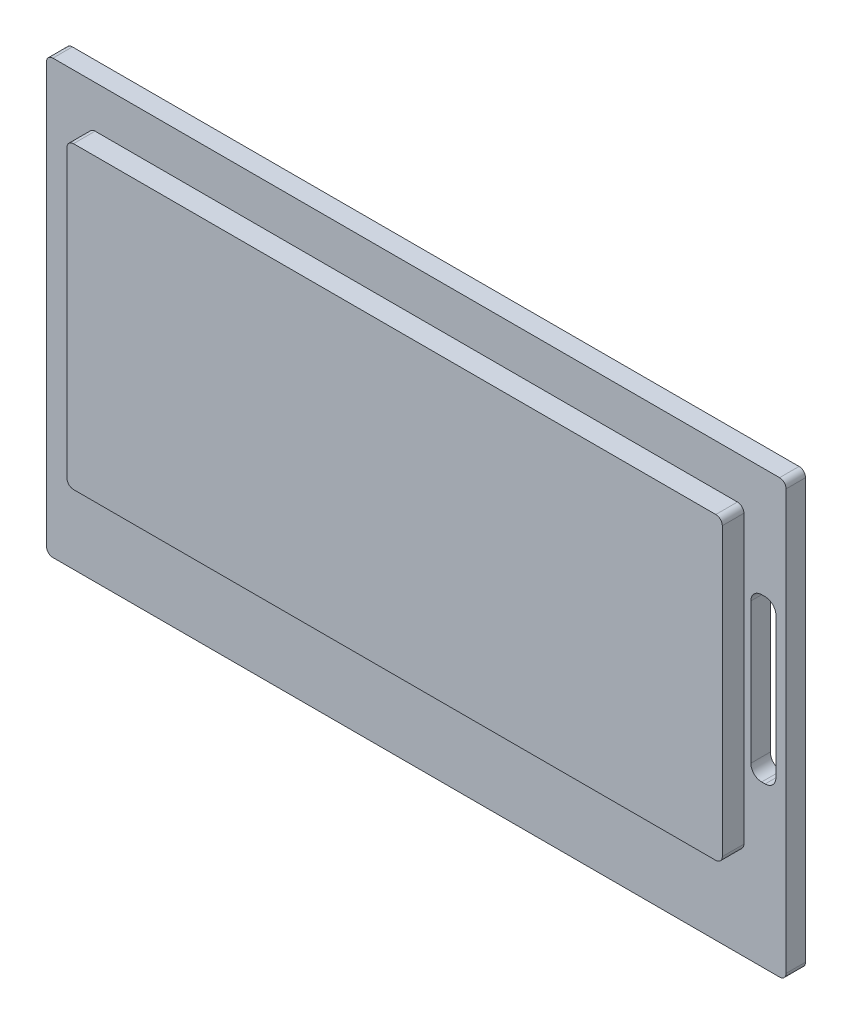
SolidWorks part; units mm, degrees
ref_plane "Plan de face" through (0, 0, 0) normal (0, 0, 1) x (1, 0, 0)
ref_plane "Plan de dessus" through (0, 0, 0) normal (0, 1, 0) x (1, 0, 0)
ref_plane "Plan de droite" through (0, 0, 0) normal (1, 0, 0) x (0, 0, -1)
sketch "Esquisse2" plane through (0, 0, 0) normal (0, 0, 1) x (1, 0, 0)
  line L1 (-51.079, 159.7342) -> (284.921, 159.7342)
  line L2 (-54.079, 156.7342) -> (-54.079, -37.2658)
  line L3 (-51.079, -40.2658) -> (284.921, -40.2658)
  line L4 (287.921, 156.7342) -> (287.921, -37.2658)
  arc A0 (284.921, 159.7342) -> (287.921, 156.7342) centre (284.921, 156.7342) cw
  arc A1 (284.921, -40.2658) -> (287.921, -37.2658) centre (284.921, -37.2658) ccw
  arc A2 (-54.079, -37.2658) -> (-51.079, -40.2658) centre (-51.079, -37.2658) ccw
  arc A3 (-51.079, 159.7342) -> (-54.079, 156.7342) centre (-51.079, 156.7342) ccw
  dimension "D3" = 3
  dimension "D1" = 342
  dimension "D2" = 200
extrude "Boss.-Extru.1" add sketch "Esquisse2" along normal blind 19
sketch "Esquisse3" plane through (0, 0, 19) normal (0, 0, 1) x (1, 0, 0)
  line L0 (284.921, 159.7342) -> (-51.079, 159.7342) construction
  line L1 (-31.579, 140.2342) -> (265.421, 140.2342)
  line L2 (-34.579, 137.2342) -> (-34.579, 4.7342)
  line L3 (-31.579, 1.7342) -> (265.421, 1.7342)
  line L4 (268.421, 137.2342) -> (268.421, 4.7342)
  line L5 (287.921, -37.2658) -> (287.921, 156.7342) construction
  line L6 (-54.079, 156.7342) -> (-54.079, -37.2658) construction
  line L7 (-51.079, -40.2658) -> (284.921, -40.2658) construction
  arc A0 (-31.579, 140.2342) -> (-34.579, 137.2342) centre (-31.579, 137.2342) ccw
  arc A1 (-34.579, 4.7342) -> (-31.579, 1.7342) centre (-31.579, 4.7342) ccw
  arc A2 (265.421, 1.7342) -> (268.421, 4.7342) centre (265.421, 4.7342) ccw
  arc A3 (265.421, 140.2342) -> (268.421, 137.2342) centre (265.421, 137.2342) cw
  dimension "D5" = 3
  dimension "D1" = 19.5
  dimension "D2" = 19.5
  dimension "D3" = 19.5
  dimension "D4" = 42
extrude "Enlèv. mat.-Extru.1" cut sketch "Esquisse3" against normal blind 10 flip side to cut
sketch "Esquisse5" plane through (0, 0, 0) normal (0, 0, -1) x (-1, 0, 0)
  line L5 (-278.221, 108.7342) -> (-276.621, 108.7342)
  line L6 (-283.221, 103.7342) -> (-283.221, 38.7342)
  line L7 (-278.221, 33.7342) -> (-276.621, 33.7342)
  line L8 (-271.621, 103.7342) -> (-271.621, 38.7342)
  arc A0 (-283.221, 38.7342) -> (-278.221, 33.7342) centre (-278.221, 38.7342) ccw
  arc A1 (-276.621, 33.7342) -> (-271.621, 38.7342) centre (-276.621, 38.7342) ccw
  arc A2 (-276.621, 108.7342) -> (-271.621, 103.7342) centre (-276.621, 103.7342) cw
  arc A3 (-278.221, 108.7342) -> (-283.221, 103.7342) centre (-278.221, 103.7342) ccw
  dimension "D1" = 5
extrude "Enlèv. mat.-Extru.2" cut sketch "Esquisse5" against normal through all
